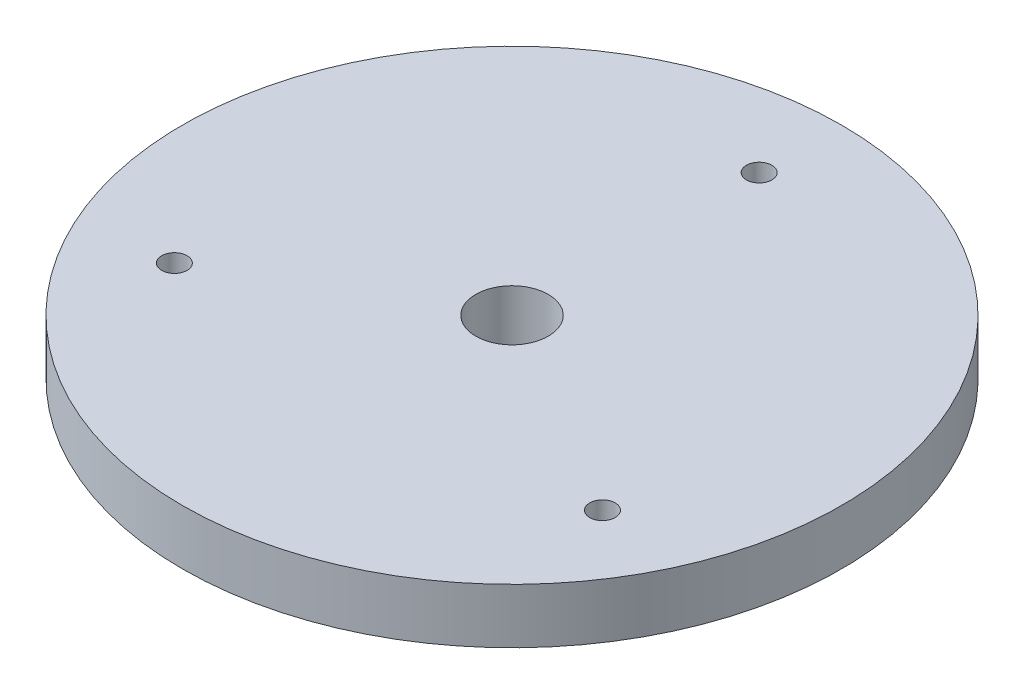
SolidWorks part; units mm, degrees
ref_plane "Front Plane" through (0, 0, 0) normal (0, 0, 1) x (1, 0, 0)
ref_plane "Top Plane" through (0, 0, 0) normal (0, 1, 0) x (1, 0, 0)
ref_plane "Right Plane" through (0, 0, 0) normal (1, 0, 0) x (0, 0, -1)
sketch "Sketch1" plane through (0, 0, 0) normal (0, 1, 0) x (1, 0, 0)
  circle A0 centre (0, 0) radius 38.1
  circle A1 centre (0, 28.575) radius 1.4732
  circle A2 centre (0, 0) radius 28.575 construction
  circle A3 centre (24.7467, -14.2875) radius 1.4732
  circle A4 centre (-24.7467, -14.2875) radius 1.4732
  circle A5 centre (0, 0) radius 4.191
  point P13 (0, 0)
  dimension "D1" = 76.2
  dimension "D2" = 57.15
  dimension "D3" = 2.9464
  dimension "D5" = 8.382
  dimension "D4" = 3
extrude "Boss-Extrude1" add sketch "Sketch1" along normal blind 6.35
